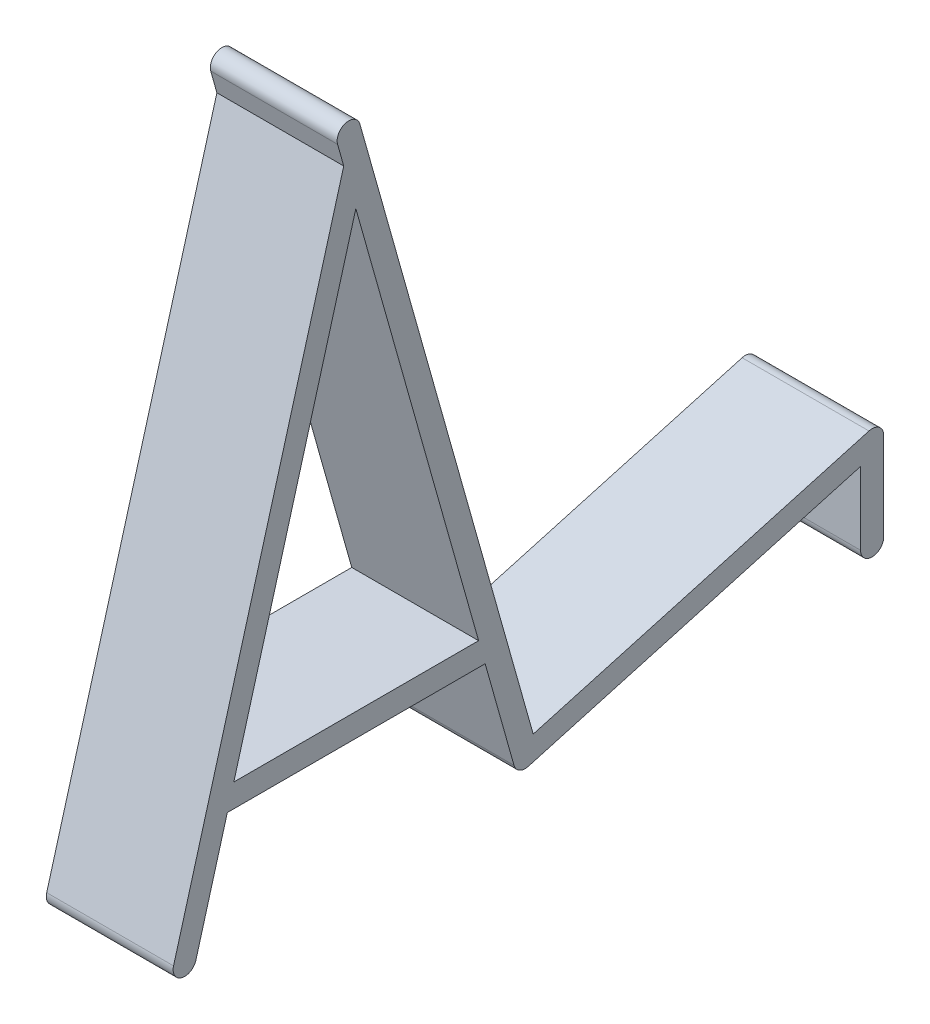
SolidWorks part; units mm, degrees
ref_plane "Front Plane" through (0, 0, 0) normal (0, 0, 1) x (1, 0, 0)
ref_plane "Top Plane" through (0, 0, 0) normal (0, 1, 0) x (1, 0, 0)
ref_plane "Right Plane" through (0, 0, 0) normal (1, 0, 0) x (0, 0, -1)
other "Graphic1"
other "Graphic (Closed) -1"
sketch "Sketch1" plane through (0, 0, 0) normal (1, 0, 0) x (0, 0, -1)
  line L0 (-81.1566, 128.8648) -> (-45.826, 3.5051) construction
  line L1 (-78.9196, 129.4953) -> (-43.589, 4.1356)
  line L2 (-83.3937, 128.2343) -> (-48.0631, 2.8746)
  line L3 (-114.0008, 1.5628) -> (-79.7449, 123.8556) construction
  line L4 (-116.2388, 2.1897) -> (-81.9829, 124.4825)
  line L5 (-111.7627, 0.9359) -> (-77.5068, 123.2287)
  line L6 (-52.085, 25.7132) -> (-107.2359, 25.7132) construction
  line L7 (-52.085, 23.389) -> (-107.2359, 23.389)
  line L8 (-52.085, 28.0374) -> (-107.2359, 28.0374)
  line L9 (-45.826, 3.5051) -> (23.642, 23.0835) construction
  line L10 (-46.4565, 5.7421) -> (23.0115, 25.3206)
  line L11 (-45.1955, 1.268) -> (24.2724, 20.8465)
  arc A0 (-78.9196, 129.4953) -> (-83.3937, 128.2343) centre (-81.1566, 128.8648) ccw
  arc A1 (-48.0631, 2.8746) -> (-43.589, 4.1356) centre (-45.826, 3.5051) ccw
  arc A2 (-116.2388, 2.1897) -> (-111.7627, 0.9359) centre (-114.0008, 1.5628) ccw
  arc A3 (-77.5068, 123.2287) -> (-81.9829, 124.4825) centre (-79.7449, 123.8556) ccw
  arc A4 (-52.085, 23.389) -> (-52.085, 28.0374) centre (-52.085, 25.7132) ccw
  arc A5 (-107.2359, 28.0374) -> (-107.2359, 23.389) centre (-107.2359, 25.7132) ccw
  arc A6 (-46.4565, 5.7421) -> (-45.1955, 1.268) centre (-45.826, 3.5051) ccw
  arc A7 (24.2724, 20.8465) -> (23.0115, 25.3206) centre (23.642, 23.0835) ccw
  point P2 (-63.4913, 66.1849)
  point P7 (-96.8728, 62.7092)
  point P14 (-79.6605, 25.7132)
  point P23 (-11.092, 13.2943)
  dimension "D1" = 2.3242
  dimension "D2" = 130.2433
  dimension "D3" = 90
  dimension "D4" = 69.85
  dimension "D5" = 127
extrude "Boss-Extrude1" add sketch "Sketch1" along normal blind 25.4 contours L1 A1 L2 A0 | L10 A7 L11 A6 | L7 A5 L8 A4 | L5 A3 L4 A2
sketch "Sketch2" [suppressed] plane through (0, 0, 0) normal (-1, 0, 0) x (0, 0, 1)
  line L0 (122.5657, -1.0063) -> (-28.2088, 3.2892)
  line L1 (-28.2088, 3.2892) -> (-28.2088, -10.237)
  line L2 (-28.2088, -10.237) -> (122.5657, -14.5325)
  line L3 (122.5657, -14.5325) -> (122.5657, -1.0063)
  arc A0 (111.7627, 0.9359) -> (116.2388, 2.1897) centre (114.0008, 1.5628) ccw construction
  arc A1 (45.1955, 1.268) -> (48.0631, 2.8746) centre (45.826, 3.5051) ccw construction
sketch "Sketch3" plane through (0, 0, 0) normal (-1, 0, 0) x (0, 0, 1)
  line L0 (-23.642, 23.0835) -> (-23.642, 5.4841) construction
  line L1 (-21.3179, 23.0835) -> (-21.3179, 5.4841)
  line L2 (-25.9661, 23.0835) -> (-25.9661, 5.4841)
  line L3 (120.5321, -0.9484) -> (-69.3972, 4.4626) construction
  arc A0 (-21.3179, 23.0835) -> (-25.9661, 23.0835) centre (-23.642, 23.0835) ccw
  arc A1 (-25.9661, 5.4841) -> (-21.3179, 5.4841) centre (-23.642, 5.4841) ccw
  arc A3 (45.1955, 1.268) -> (48.0631, 2.8746) centre (45.826, 3.5051) ccw construction
  arc A4 (111.7627, 0.9359) -> (116.2388, 2.1897) centre (114.0008, 1.5628) ccw construction
  point P3 (-23.642, 14.2838)
  point P10 (120.5206, -1.3186)
  point P16 (-23.642, 7.2165)
  point P17 (-21.3179, 3.3076)
  point P18 (115.2167, -0.4179)
  dimension "D1" = 2.3241
extrude "Boss-Extrude2" add sketch "Sketch3" against normal blind 25.4
